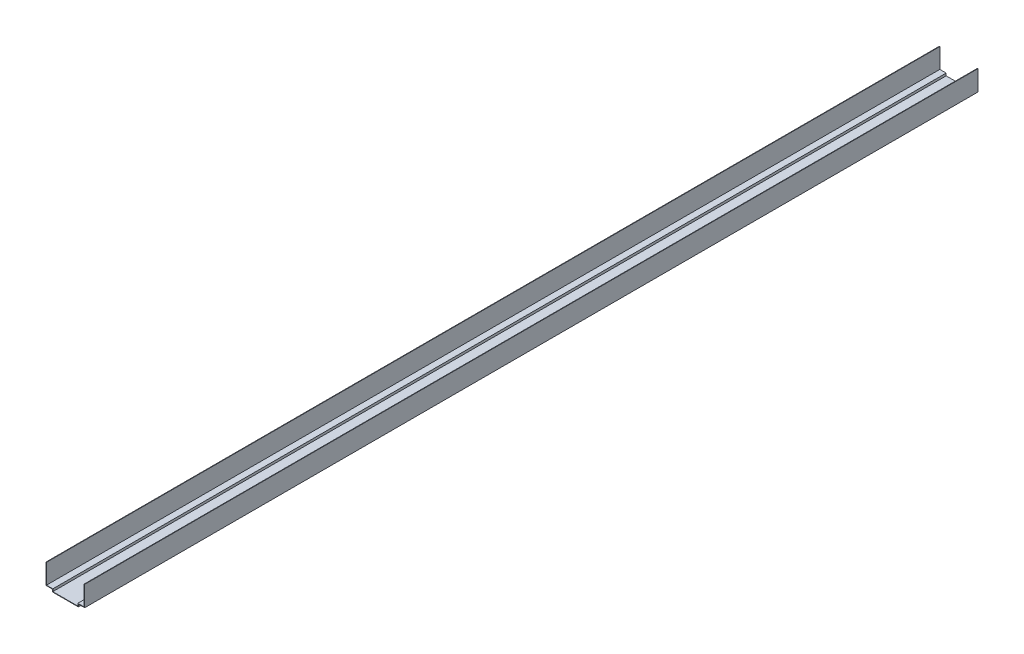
SolidWorks part; units mm, degrees
ref_plane "Ebene vorne" through (0, 0, 0) normal (0, 0, 1) x (1, 0, 0)
ref_plane "Ebene oben" through (0, 0, 0) normal (0, 1, 0) x (1, 0, 0)
ref_plane "Ebene rechts" through (0, 0, 0) normal (1, 0, 0) x (0, 0, -1)
sketch "MasterSeite" plane through (0, 0, 0) normal (1, 0, 0) x (0, 0, -1)
  line L1 (0, 140) -> (7200, 140)
  line L2 (0, 140) -> (0, 0)
  line L3 (0, 0) -> (7200, 0)
  line L4 (7200, 140) -> (7200, 0)
  dimension "ModYAblrinLtot__" = 7200
  dimension "ModYAblrinH__" = 140
sketch "Skizze1" plane through (0, 0, 0) normal (0, 0, 1) x (1, 0, 0)
  line L0 (0, 155.169) -> (0, 0) construction
  line L1 (-119, 140.01) -> (-119, 15)
  line L2 (119, 140.01) -> (119, 15)
  line L3 (-119, 15) -> (-80, 15)
  line L4 (119, 15) -> (80, 15)
  line L5 (-80, 15) -> (-80, 0)
  line L6 (80, 15) -> (80, 0)
  line L7 (-80, 0) -> (80, 0)
  line L8 (-116, 140.01) -> (-116, 18)
  line L9 (-116, 18) -> (-77, 18)
  line L10 (-77, 18) -> (-77, 3)
  line L11 (-77, 3) -> (77, 3)
  line L12 (77, 18) -> (77, 3)
  line L13 (116, 18) -> (77, 18)
  line L14 (116, 140.01) -> (116, 18)
  line L15 (-119, 140.01) -> (-116, 140.01)
  line L16 (116, 140.01) -> (119, 140.01)
  dimension "D1" = 154
  dimension "D3" = 238
  dimension "D5" = 15
  dimension "D7" = 140.01
  dimension "D2" = 3
extrude "Linear austragen1" add sketch "Skizze1" along direction (0, 0, -1) on the side against the normal blind 5500
